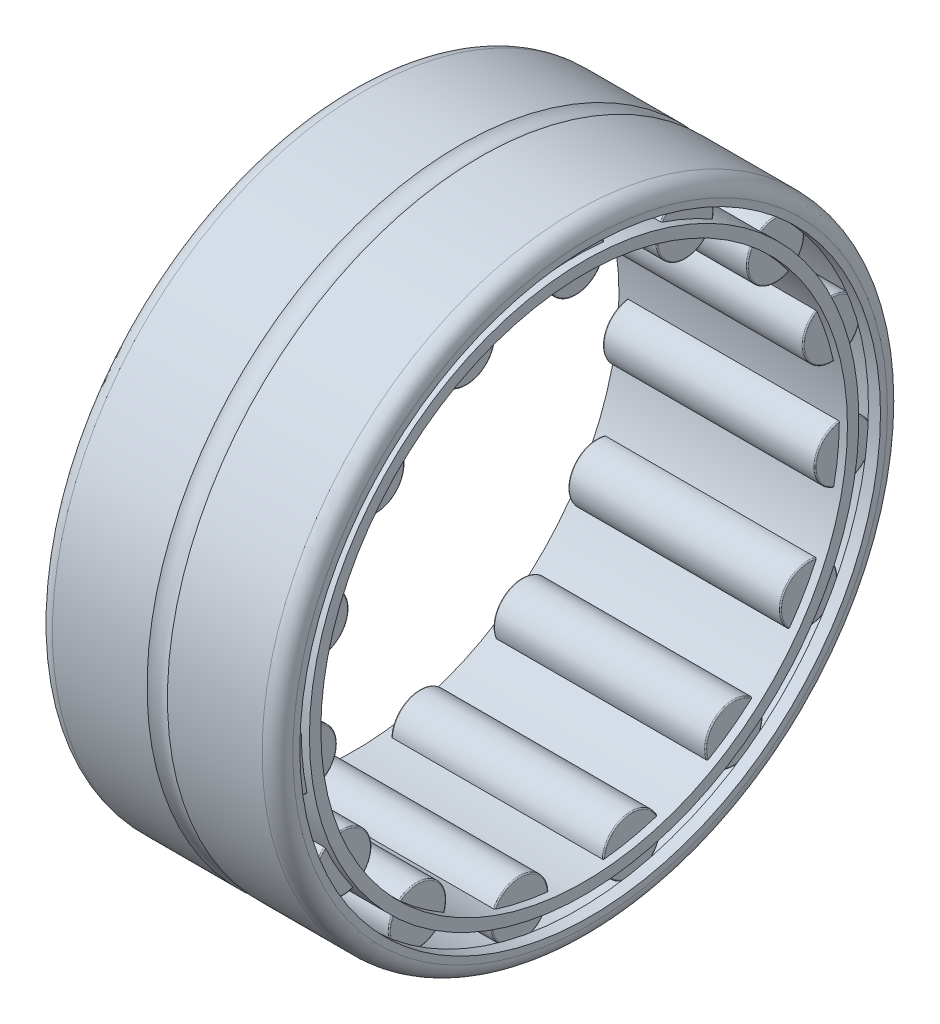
SolidWorks part; units mm, degrees
ref_plane "Plane1" through (0, 0, 0) normal (0, 0, 1) x (1, 0, 0)
ref_plane "Plane2" through (0, 0, 0) normal (0, 1, 0) x (1, 0, 0)
ref_plane "Plane3" through (0, 0, 0) normal (1, 0, 0) x (0, 0, -1)
other "Configuration Table"
sketch "Clipboard" plane through (0, 0, 0) normal (0, 0, 1) x (1, 0, 0)
  line L0 (-10, 0) -> (10, 0) construction
  line L1 (41.1529, 1.4371) -> (62.7517, -4.3503)
  line L2 (41.1529, 1.4371) -> (75.4583, 10.6292)
  line L3 (41.1529, 1.4371) -> (62.7517, -4.3503)
  line L4 (41.1529, 1.4371) -> (-22.3471, -0.7804)
sketch "InnRacSke" plane through (0, 0, 0) normal (0, 0, 1) x (1, 0, 0)
  line L0 (-14.2875, 38.3286) -> (-15.875, 38.3286)
  line L1 (-15.875, 38.3286) -> (-15.875, 39.243)
  line L2 (-13.843, 41.275) -> (-1.344, 41.275)
  line L3 (1.344, 41.275) -> (13.843, 41.275)
  line L4 (15.875, 39.243) -> (15.875, 38.3286)
  line L5 (15.875, 38.3286) -> (14.2875, 38.3286)
  line L6 (14.2875, 38.3286) -> (14.2875, 39.2811)
  line L7 (14.2875, 39.2811) -> (-14.2875, 39.2811)
  line L8 (-14.2875, 39.2811) -> (-14.2875, 38.3286)
  line L9 (-31.75, 0) -> (31.75, 0) construction
  arc A0 (-15.875, 39.243) -> (-13.843, 41.275) centre (-13.843, 39.243) cw
  arc A1 (-1.344, 41.275) -> (1.344, 41.275) centre (0, 42.799) ccw
  arc A2 (13.843, 41.275) -> (15.875, 39.243) centre (13.843, 39.243) cw
revolve "Race" add sketch "InnRacSke" angle 360 about L9
sketch "RolDetSke" plane through (0, 0, 0) normal (0, 0, 1) x (1, 0, 0)
  line L0 (-14.0018, 39.131) -> (-14.0017, 35.5155)
  line L1 (-14.0017, 35.5155) -> (14.0017, 35.5155)
  line L2 (14.0017, 35.5155) -> (14.0018, 39.131)
  line L3 (13.8511, 39.2816) -> (-13.8511, 39.2816)
  line L4 (-28.575, 35.5155) -> (28.575, 35.5155) construction
  arc A0 (14.0018, 39.131) -> (13.8511, 39.2816) centre (13.8511, 39.131) ccw
  arc A1 (-13.8511, 39.2816) -> (-14.0018, 39.131) centre (-13.8511, 39.131) ccw
revolve "RollerDetailed" add sketch "RolDetSke" angle 360 about L4
ref_axis "Axis1" through (-50, 0, 0) along (1, 0, 0)
sketch "CagSpiSke" plane through (0, 0, 0) normal (0, 0, 1) x (1, 0, 0)
  line L0 (15.0812, 34.7623) -> (15.0812, 36.2688)
  line L1 (15.0812, 36.2688) -> (-15.0813, 36.2688)
  line L2 (-15.0813, 36.2688) -> (-15.0813, 34.7623)
  line L3 (-15.0813, 34.7623) -> (15.0812, 34.7623)
  line L4 (-31.75, 0) -> (31.75, 0) construction
revolve "CageSpine" add sketch "CagSpiSke" angle 360 about L4
pattern_circular "RollersDetailed" count 15 every 24 about axis through (-50, 0, 0) along (1, 0, 0) of "RollerDetailed"
sketch "RolSimSke" plane through (0, 0, 0) normal (0, 0, 1) x (1, 0, 0)
  line L0 (-25.4, 0) -> (25.4, 0) construction
  line L2 (-13.8511, 39.2821) -> (13.8511, 39.2821)
  line L3 (-14.0018, 39.1315) -> (-14.0018, 31.9006)
  line L4 (-13.8511, 31.75) -> (13.8511, 31.75)
  line L5 (14.0017, 39.1315) -> (14.0017, 31.9006)
  arc A0 (-14.0018, 31.9006) -> (-13.8511, 31.75) centre (-13.8511, 31.9006) ccw
  arc A1 (-13.8511, 39.2821) -> (-14.0018, 39.1315) centre (-13.8511, 39.1315) ccw
  arc A2 (14.0017, 39.1315) -> (13.8511, 39.2821) centre (13.8511, 39.1315) ccw
  arc A3 (13.8511, 31.75) -> (14.0017, 31.9006) centre (13.8511, 31.9006) ccw
  point P10 (-14.0018, 31.75)
  point P15 (14.0017, 39.2821)
  point P18 (14.0017, 31.75)
revolve "RollersSimplified" [suppressed] add sketch "RolSimSke" angle 360 about L0
equation "\"BallCLRad@Clipboard\" =  ( \"D1@InnRacSke\" + \"Bore@Clipboard\" )  / 4"
equation "\"RollerCLRad@RolDetSke\" = \"BallCLRad@Clipboard\""
equation "\"offset@InnRacSke\" = \"radius@InnRacSke\" * .75"
equation "\"halfCyl@InnRacSke\" = \"Cyl_Len@InnRacSke\" / 2"
equation "\"Roller_diameter@RolDetSke\" =  ( \"D1@InnRacSke\" - \"Bore@Clipboard\" )  / 2 + .001"
equation "\"Roller_radius@RolDetSke\" = \"Roller_diameter@RolDetSke\" / 50"
equation "\"Roller_length@RolDetSke\" = \"Cyl_Len@InnRacSke\" * .98"
equation "\"halfLength@RolDetSke\" = \"Roller_length@RolDetSke\" / 2"
equation "\"Cage_width@CagSpiSke\" =  ( \"Cyl_Len@InnRacSke\" + \"Width@InnRacSke\" )  / 2"
equation "\"halfWidth@CagSpiSke\" = \"Cage_width@CagSpiSke\" / 2"
equation "\"Cage_thickness@CagSpiSke\"  = \"Roller_diameter@RolDetSke\" / 5"
equation "\"D2@CagSpiSke\" =  \"RollerCLRad@RolDetSke\" * 2 - \"Cage_thickness@CagSpiSke\""
equation "\"Roller_length@RolSimSke\" = \"Cyl_Len@InnRacSke\" * .98"
equation "\"halfWidth@RolSimSke\" = \"Roller_length@RolSimSke\" / 2"
equation "\"D1@RolSimSke\" = \"Roller_radius@RolDetSke\""
equation "\"Roller_diameter@RolSimSke\" =  ( \"D1@InnRacSke\" - \"Bore@Clipboard\" )  / 2 + .001"
equation "\"Max_count@Clipboard\" = int( 3.14159265 / atn(( \"Roller_diameter@RolDetSke\" / 2) / sqr( \"RollerCLRad@RolDetSke\"  *  \"RollerCLRad@RolDetSke\" - ( \"Roller_diameter@RolDetSke\" / 2) *  ( \"Roller_diameter@R"
equation "\"Max_count@Clipboard\" = ((sgn( \"Max_count@Clipboard\" - \"Count@Clipboard\" )-1)*( \"Max_count@Clipboard\" - \"Count@Clipboard\" ))/-2+ \"Count@Clipboard\""
equation "\"Count@RollersDetailed\" = int( \"Show_count@Clipboard\" ) "
equation "\"Count@RollersDetailed\" = ((sgn( \"Count@RollersDetailed\" - \"Max_count@Clipboard\" )-1)*( \"Count@RollersDetailed\" - \"Max_count@Clipboard\" ))/-2+ \"Max_count@Clipboard\""
equation "\"Count@RollersDetailed\" = ((sgn( \"Count@RollersDetailed\" - \"Min_count@Clipboard\" )+1)*( \"Count@RollersDetailed\" - \"Min_count@Clipboard\"))/2 +\"Min_count@Clipboard\""
equation "\"Angle@RollersDetailed\" = 360.0 / \"Max_count@Clipboard\""
equation "\"Angle@CageSpine\" =  \"Angle@RollersDetailed\" * ( \"Count@RollersDetailed\" -1 + int( \"Count@RollersDetailed\" / \"Max_count@Clipboard\" ) )  + 0.001 -  int( \"Count@RollersDetailed\" / \"Max_count@Clipboard\" "
equation "\"Angle@CageSpine\" =  \"Angle@CageSpine\" * int( \"Min_count@Clipboard\" / 2) + int(1 / \"Min_count@Clipboard\")  * 0.001"
equation "\"Bore@RolSimSke\" = \"Bore@Clipboard\""
